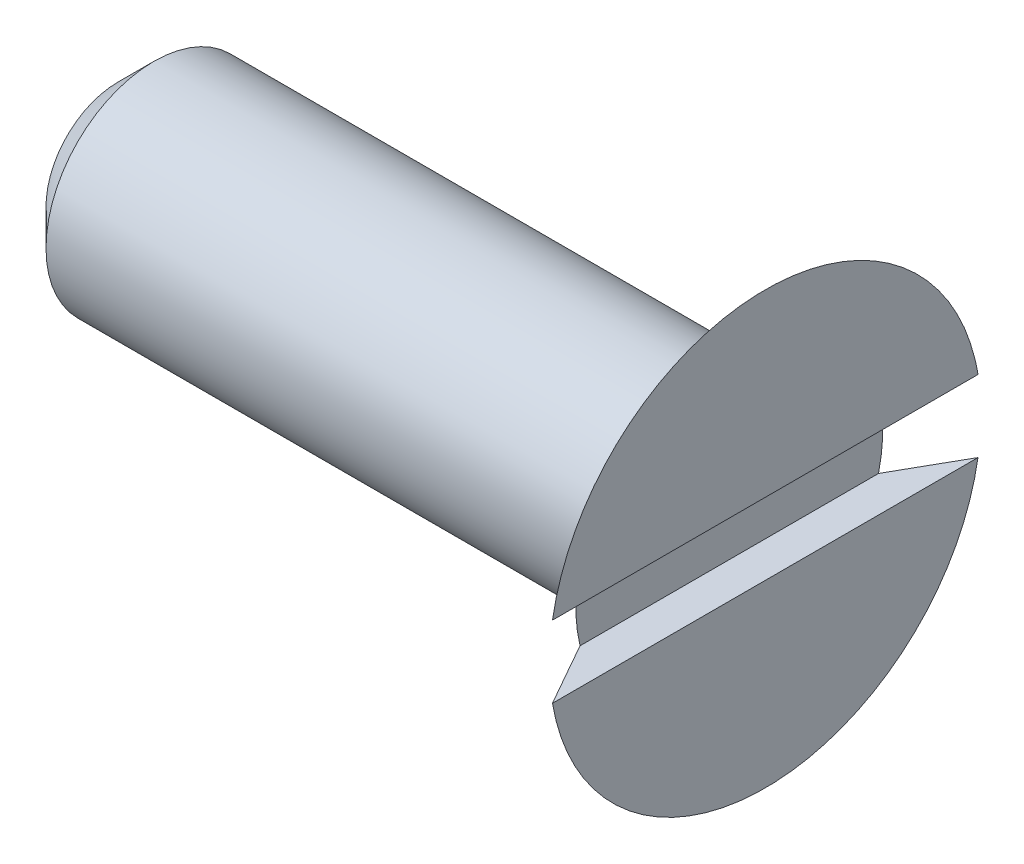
SolidWorks part; units mm, degrees
ref_plane "Face" through (0, 0, 0) normal (0, 0, 1) x (1, 0, 0)
ref_plane "Dessus" through (0, 0, 0) normal (0, 1, 0) x (1, 0, 0)
ref_plane "Droite" through (0, 0, 0) normal (1, 0, 0) x (0, 0, -1)
sketch "Esquisse1" plane through (0, 0, 0) normal (0, 0, 1) x (1, 0, 0)
  line L0 (25.0907, 0) -> (38.2671, 0) construction
  line L1 (25.0907, 0) -> (25.0907, 3)
  line L2 (25.0907, 3) -> (41.3586, 3)
  line L3 (41.3586, 3) -> (43.0907, 6)
  line L4 (43.0907, 6) -> (43.0907, 0)
  line L5 (43.0907, 0) -> (25.0907, 0)
  dimension "D1" = 3
  dimension "D2" = 6
  dimension "D3" = 18
  dimension "D4" = 60
revolve "Révolution1" add sketch "Esquisse1" angle 360 about L0
chamfer "Chanfrein1" distance 1 angle 45 1 edges at (25.0907, -3, 0)
sketch "Esquisse2" plane through (43.0907, 0, 0) normal (1, 0, 0) x (0, 0, -1)
  line L1 (-6.6344, -1) -> (6.6703, -1)
  line L2 (-6.6344, -1) -> (-6.6344, 1)
  line L3 (-6.6344, 1) -> (6.6703, 1)
  line L4 (6.6703, -1) -> (6.6703, 1)
  dimension "D1" = 2
  dimension "D2" = 1
extrude "Enlèv. mat.-Extru.1" cut sketch "Esquisse2" against normal blind 1
